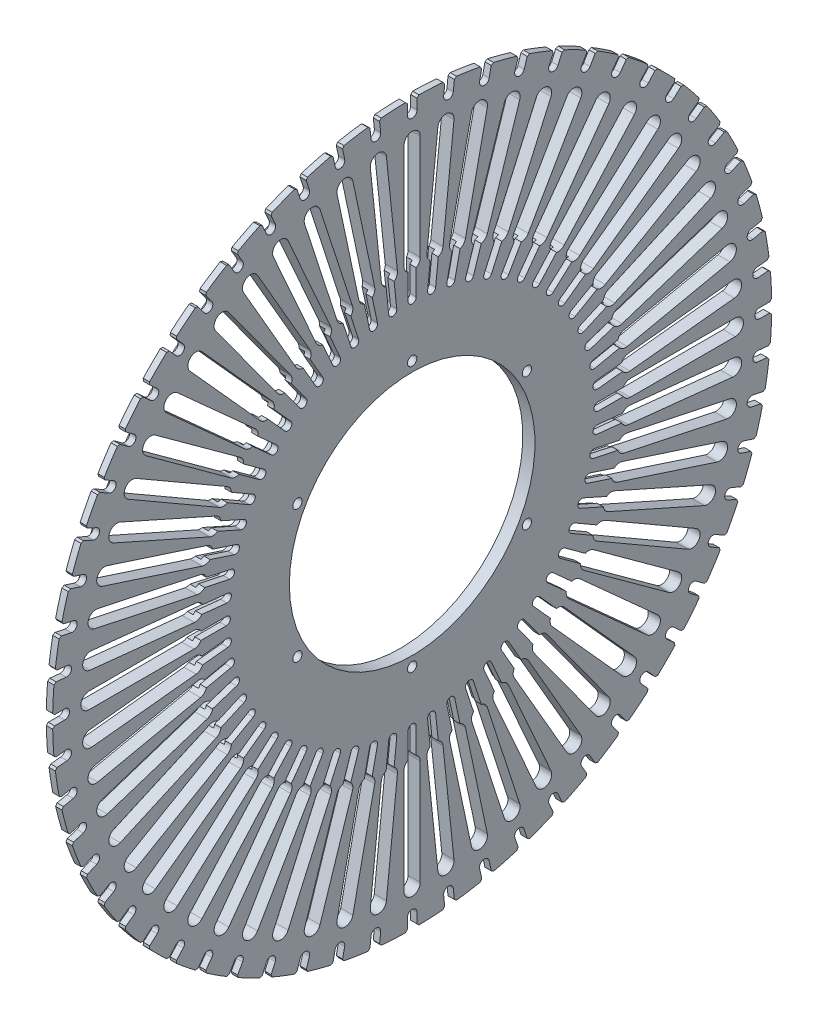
SolidWorks part; units mm, degrees
ref_plane "Front Plane" through (0, 0, 0) normal (0, 0, 1) x (1, 0, 0)
ref_plane "Top Plane" through (0, 0, 0) normal (0, 1, 0) x (1, 0, 0)
ref_plane "Right Plane" through (0, 0, 0) normal (1, 0, 0) x (0, 0, -1)
sketch "Sketch1" plane through (0, 0, 0) normal (0, 0, 1) x (1, 0, 0)
  line L0 (0, 0) -> (54.1523, 0) construction
  line L1 (0, 48.26) -> (0, 132.08)
  line L2 (0, 132.08) -> (2.286, 132.08)
  line L3 (4.7752, 141.2875) -> (4.7752, 48.26)
  line L4 (4.7752, 48.26) -> (0, 48.26)
  line L5 (2.286, 132.08) -> (2.286, 141.2875)
  line L6 (2.286, 141.2875) -> (4.7752, 141.2875)
  dimension "D1" = 282.575
  dimension "D2" = 4.7752
  dimension "D3" = 96.52
  dimension "D4" = 264.16
  dimension "D5" = 2.286
revolve "Revolve1" add sketch "Sketch1" angle 360 about L0
sketch "Sketch2" plane through (4.7752, 0, 0) normal (1, 0, 0) x (0, 0, -1)
  line L0 (0, 0) -> (0, 132.08) construction
  line L1 (0, 0) -> (6.9125, 131.899) construction
  line L2 (-3.175, 127) -> (-3.175, 85.725)
  line L3 (3.175, 127) -> (3.175, 85.725)
  arc A0 (3.175, 127) -> (-3.175, 127) centre (0, 127) ccw
  arc A1 (-3.175, 85.725) -> (3.175, 85.725) centre (0, 85.725) ccw
  circle A2 centre (0, 0) radius 132.08 construction
  circle A3 centre (0, 0) radius 48.26 construction
  dimension "D2" = 6.35
  dimension "D3" = 6.35
  dimension "D4" = 85.725
  dimension "D5" = 127
  dimension "D1" = 3
extrude "Cut-Extrude1" cut sketch "Sketch2" against normal through all
sketch "Sketch4" plane through (4.7752, 0, 0) normal (1, 0, 0) x (0, 0, -1)
  line L0 (-1.905, 136.525) -> (-1.905, 153.0768)
  line L1 (-1.905, 153.0768) -> (1.905, 153.0768)
  line L2 (1.905, 153.0768) -> (1.905, 136.525)
  line L3 (0, 136.525) -> (0, 0) construction
  arc A0 (-1.905, 136.525) -> (1.905, 136.525) centre (0, 136.525) ccw
  circle A1 centre (0, 0) radius 48.26 construction
  dimension "D1" = 3.81
  dimension "D2" = 136.525
extrude "Cut-Extrude2" cut sketch "Sketch4" against normal through all
chamfer "Chamfer1" distance 0.762 angle 45 2 edges at (3.5306, 141.2747, -1.905) (3.5306, 141.2747, 1.905)
hole_wizard "CSK for #6 Flat Head Machine Screw1" positions "Sketch6" profile "Sketch5" countersink size "#6" standard "ANSI Inch"
sketch "Sketch6" plane through (0, 0, 0) normal (-1, 0, 0) x (0, 0, 1)
  line L0 (0, 0) -> (0, 52.07) construction
  circle A0 centre (0, 0) radius 52.07 construction
  point P0 (0, 52.07)
  dimension "D1" = 104.14
sketch "Sketch5" plane through (0, 52.07, 0) normal (0, 1, 0) x (0, 0, 1)
  line L0 (0, 0) -> (0, 4.7752)
  line L1 (0, 4.7752) -> (1.8288, 4.7752)
  line L2 (1.8288, 4.7752) -> (1.8288, 1.9723)
  line L3 (1.8288, 1.9723) -> (3.5433, 0)
  line L5 (3.5433, 0) -> (0, 0)
  line L6 (-1.8288, 1.9723) -> (-3.5433, 0) construction
  line L11 (0, -6.35) -> (0, 107.95) construction
  dimension "Thru Hole Dia." = 3.6576
  dimension "Thru Hole Depth" = 4.7752
  dimension "Near C'Sink Dia." = 7.0866
  dimension "Near C'Sink Angle" = 82
sketch "Sketch8" plane through (4.7752, 0, 0) normal (1, 0, 0) x (0, 0, -1)
  line L0 (0, 85.725) -> (0, 73.025) construction
  line L1 (1.5875, 85.725) -> (1.5875, 73.025)
  line L2 (-1.5875, 85.725) -> (-1.5875, 73.025)
  arc A0 (1.5875, 85.725) -> (-1.5875, 85.725) centre (0, 85.725) ccw
  arc A1 (-1.5875, 73.025) -> (1.5875, 73.025) centre (0, 73.025) ccw
  circle A2 centre (0, 0) radius 73.025 construction
  point P4 (0, 79.375)
  dimension "D2" = 146.05
  dimension "D1" = 3.175
extrude "Cut-Extrude3" cut sketch "Sketch8" against normal through all
sketch "Sketch9" plane through (0, 0, 0) normal (-1, 0, 0) x (0, 0, 1)
  line L0 (0, 73.025) -> (0, 85.725) construction
  line L1 (-2.54, 73.025) -> (-2.54, 85.725)
  line L2 (2.54, 73.025) -> (2.54, 85.725)
  arc A0 (-2.54, 73.025) -> (2.54, 73.025) centre (0, 73.025) ccw
  arc A1 (2.54, 85.725) -> (-2.54, 85.725) centre (0, 85.725) ccw
  point P4 (0, 79.375)
  dimension "D1" = 5.08
extrude "Cut-Extrude4" cut sketch "Sketch9" against normal up to surface (2.286 mm away)
pattern_circular "CirPattern1" count 60 over 360 about axis through (0, 0, 0) along (1, 0, 0) of "Cut-Extrude1", "Cut-Extrude2", "Chamfer1", "Cut-Extrude3", "Cut-Extrude4"
pattern_circular "CirPattern2" count 6 over 360 about axis through (0, 0, 0) along (1, 0, 0) of "CSK for #6 Flat Head Machine Screw1"
